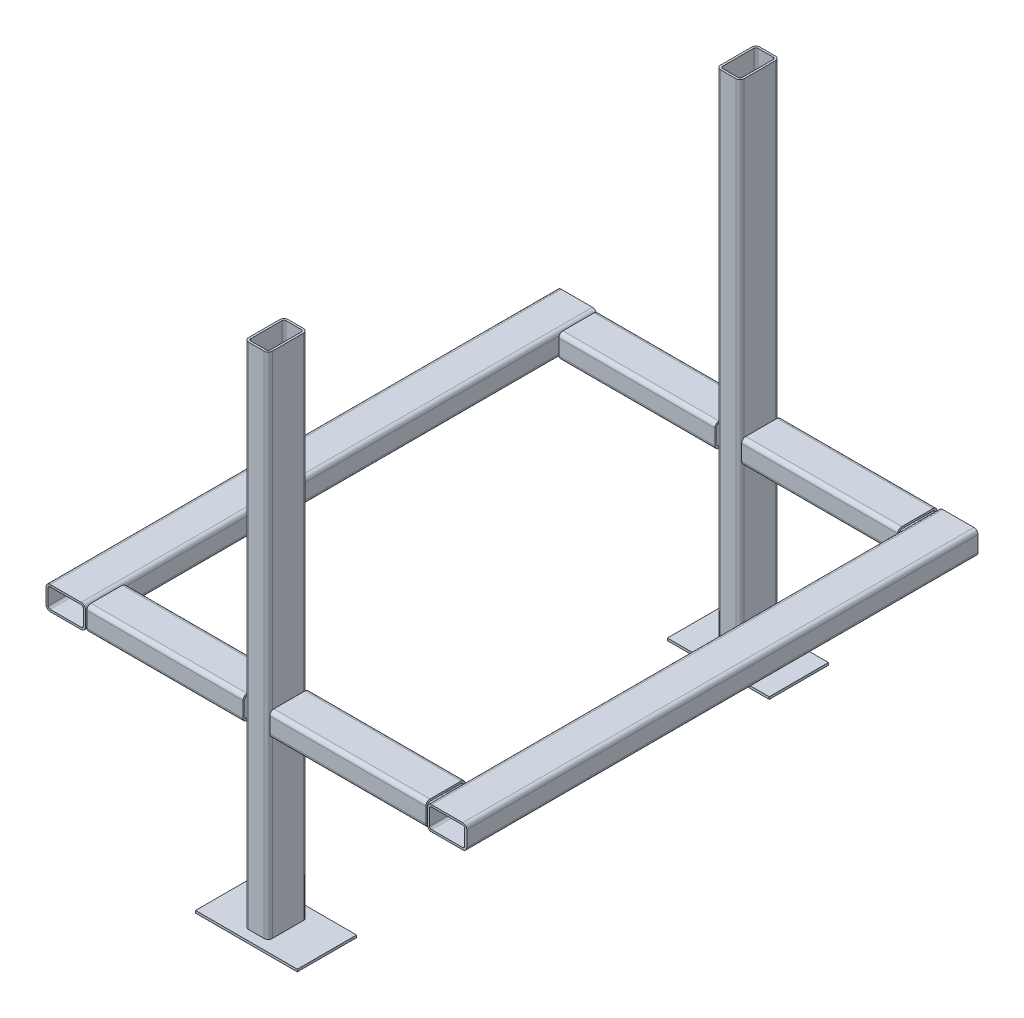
SolidWorks part; units mm, degrees
ref_plane "Front Plane" through (0, 0, 0) normal (0, 0, 1) x (1, 0, 0)
ref_plane "Top Plane" through (0, 0, 0) normal (0, 1, 0) x (1, 0, 0)
ref_plane "Right Plane" through (0, 0, 0) normal (1, 0, 0) x (0, 0, -1)
sketch "Sketch2"
extrude "Extrude1" add sketch "Sketch2" along normal blind 3
sketch "Sketch3"
other "Structural Member1"
ref_plane "Plane1" through (0, 0, 0) normal (0, 1, 0) x (-1, 0, 0)
sketch "Sketch1"
  dimension "D1" = 5.2
  dimension "D2" = 4.7625
  dimension "D3" = 6.604
  dimension "D4" = 41.275
  dimension "D5" = 41.275
  dimension "D6" = 4.7625
  dimension "D7" = 6.35
  dimension "D8" = 6.35
  dimension "Thickness" = 2.6
  dimension "V_leg" = 50
  dimension "H_leg" = 30
other "Structural Member2"
ref_plane "Plane3" through (-303.4274, 537.9257, 0) normal (1, 0, 0) x (0, 1, 0)
sketch "Sketch17"
  dimension "D1" = 5.2
  dimension "D2" = 4.7625
  dimension "D3" = 6.604
  dimension "D4" = 41.275
  dimension "D5" = 41.275
  dimension "D6" = 4.7625
  dimension "D7" = 6.35
  dimension "D8" = 6.35
  dimension "Thickness" = 2.6
  dimension "V_leg" = 50
  dimension "H_leg" = 30
ref_plane "Plane4" through (0, 0, 300) normal (0, 0, 1) x (1, 0, 0)
mirror "Mirror1"
ref_plane "Plane6" through (0, 241.8439, 0) normal (0, -1, 0) x (1, 0, 0)
sketch "Sketch18"
other "Structural Member3"
ref_plane "Plane5" through (-242.5049, 241.8439, -25) normal (0, 0, 1) x (1, 0, 0)
sketch "Sketch19"
  dimension "D1" = 5.2
  dimension "D2" = 4.7625
  dimension "D3" = 6.604
  dimension "D4" = 41.275
  dimension "D5" = 41.275
  dimension "D6" = 4.7625
  dimension "D7" = 6.35
  dimension "D8" = 6.35
  dimension "Thickness" = 2.6
  dimension "V_leg" = 50
  dimension "H_leg" = 30
other "Trim/Extend1"
